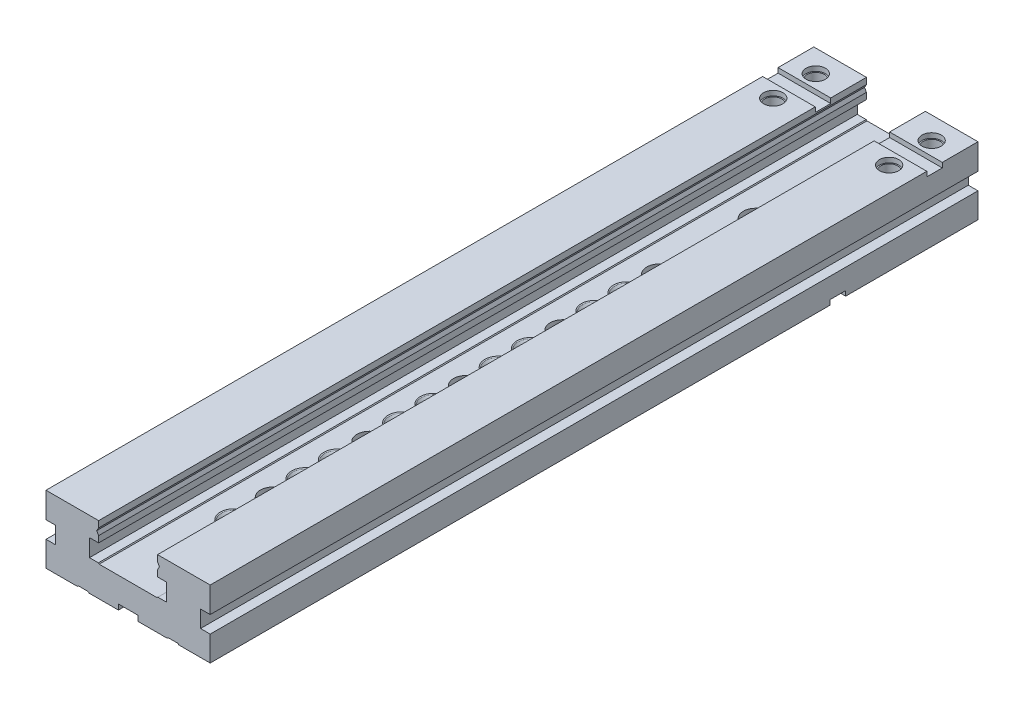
SolidWorks part; units mm, degrees
ref_plane "Front Plane" through (0, 0, 0) normal (0, 0, 1) x (1, 0, 0)
ref_plane "Top Plane" through (0, 0, 0) normal (0, 1, 0) x (1, 0, 0)
ref_plane "Right Plane" through (0, 0, 0) normal (1, 0, 0) x (0, 0, -1)
imported_body "Imported1"
sketch "Sketch1" plane through (0, -3.8, 0) normal (0, 1, 0) x (1, 0, 0)
  circle A0 centre (0, 150) radius 13
  circle A1 centre (0, 250) radius 13.0286
  circle A2 centre (0, 350) radius 13
  circle A3 centre (0, 450) radius 13
  circle A4 centre (0, 550) radius 13
  circle A5 centre (0, 650) radius 13
extrude "Boss-Extrude1" add sketch "Sketch1" against normal up to surface (25.7 mm away)
sketch "Sketch6" plane through (0, -3.8, 0) normal (0, 1, 0) x (1, 0, 0)
  circle A0 centre (0, 69) radius 14
sketch "Sketch7" plane through (0, -3.8, 0) normal (0, 1, 0) x (1, 0, 0)
  circle A0 centre (0, 69) radius 14.0315
extrude "Boss-Extrude2" add sketch "Sketch7" against normal blind 13
hole_wizard "Hole1" positions "Sketch3" profile "Sketch2" legacy
sketch "Sketch3" plane through (0, -3.8, 0) normal (0, 1, 0) x (1, 0, 0)
  line L0 (-30, 795) -> (30, 795) construction
  point P0 (0, 550)
  point P5 (0, 350)
  dimension "D1" = 245
  dimension "D2" = 200
sketch "Sketch2" plane through (0, -3.8, -550) normal (1, 0, 0) x (0, 0, 1)
  line L0 (0, 0) -> (0, 100)
  line L1 (0, 100) -> (8, 100)
  line L2 (8, 100) -> (8, 11)
  line L3 (8, 11) -> (13, 11)
  line L4 (13, 11) -> (13, 0)
  line L5 (13, 0) -> (0, 0)
  line L6 (0, 110) -> (0, -10) construction
  dimension "Diameter" = 16
  dimension "Depth" = 100
  dimension "C-Bore Diameter" = 26
  dimension "C-Bore Depth" = 11
hole_wizard "Hole2" positions "Sketch5" profile "Sketch4" legacy
sketch "Sketch5" plane through (0, -3.8, 0) normal (0, 1, 0) x (1, 0, 0)
  line L0 (-30, 795) -> (30, 795) construction
  circle A0 centre (0, 550) radius 13 construction
  point P0 (0, 650)
  point P2 (0, 450)
  point P4 (0, 250)
  point P16 (0, 150)
  dimension "D1" = 100
  dimension "D2" = 200
  dimension "D3" = 200
  dimension "D4" = 145
  dimension "D5" = 100
sketch "Sketch4" plane through (0, -3.8, -650) normal (1, 0, 0) x (0, 0, 1)
  line L0 (0, 0) -> (0, 100)
  line L1 (0, 100) -> (8.5, 100)
  line L2 (8.5, 100) -> (8.5, 17)
  line L3 (8.5, 17) -> (13, 17)
  line L4 (13, 17) -> (13, 0)
  line L5 (13, 0) -> (0, 0)
  line L6 (0, 110) -> (0, -10) construction
  dimension "Diameter" = 17
  dimension "Depth" = 100
  dimension "C-Bore Diameter" = 26
  dimension "C-Bore Depth" = 17
